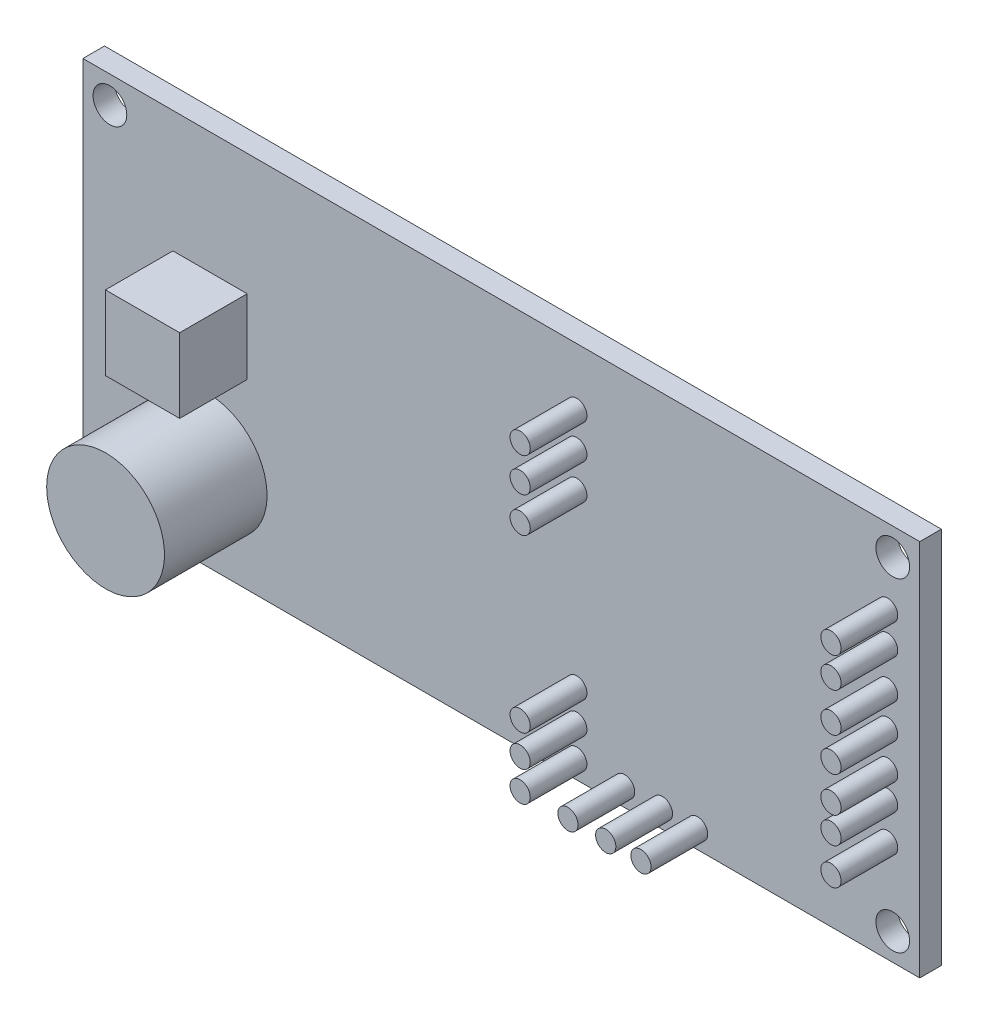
SolidWorks part; units mm, degrees
ref_plane "Front Plane" through (0, 0, 0) normal (0, 0, 1) x (1, 0, 0)
ref_plane "Top Plane" through (0, 0, 0) normal (0, 1, 0) x (1, 0, 0)
ref_plane "Right Plane" through (0, 0, 0) normal (1, 0, 0) x (0, 0, -1)
sketch "Sketch1" plane through (0, 0, 0) normal (0, 0, 1) x (1, 0, 0)
  line L0 (0, 14) -> (62, 14) construction
  line L1 (0, 0) -> (62, 0)
  line L2 (0, 0) -> (0, 28)
  line L3 (0, 28) -> (62, 28)
  line L4 (62, 0) -> (62, 28)
  circle A1 centre (2, 2) radius 1.25
  circle A2 centre (60, 26) radius 1.25
  circle A3 centre (60, 2) radius 1.25
  circle A4 centre (2, 26) radius 1.25
  dimension "D3" = 2.5
  dimension "D4" = 2.5
  dimension "D5" = 2.5
  dimension "D6" = 2.5
  dimension "D1" = 62
  dimension "D2" = 28
  dimension "D7" = 2
  dimension "D8" = 2
  dimension "D9" = 2
  dimension "D10" = 2
  dimension "D11" = 2
  dimension "D12" = 2
  dimension "D13" = 2
  dimension "D14" = 2
extrude "Extrude1" add sketch "Sketch1" along normal mid plane 1.6
sketch "Sketch3" plane through (0, 0, 0.8) normal (0, 0, 1) x (1, 0, 0)
  circle A1 centre (59.6205, 22.437) radius 0.75
  circle A2 centre (59.6205, 20.1996) radius 0.75
  circle A3 centre (59.6205, 17.3095) radius 0.75
  circle A4 centre (59.6205, 14.7924) radius 0.75
  circle A5 centre (59.6205, 12.1821) radius 0.75
  circle A6 centre (59.6205, 10.2243) radius 0.75
  circle A7 centre (59.6205, 7.5208) radius 0.75
  circle A8 centre (36.5936, 21.2251) radius 0.75
  circle A9 centre (36.5936, 23.7422) radius 0.75
  circle A10 centre (36.5936, 18.6147) radius 0.75
  circle A11 centre (36.5936, 5.9359) radius 0.75
  circle A12 centre (36.5936, 3.6052) radius 0.75
  circle A13 centre (36.5936, 1.3678) radius 0.75
  circle A14 centre (42.933, 1.3678) radius 0.75
  circle A15 centre (40.1362, 1.3678) radius 0.75
  circle A16 centre (45.5433, 1.3678) radius 0.75
  dimension "D1" = 1.5
  dimension "D2" = 1.5
  dimension "D3" = 1.5
  dimension "D4" = 1.5
  dimension "D5" = 1.5
  dimension "D6" = 1.5
  dimension "D7" = 1.5
  dimension "D8" = 1.5
  dimension "D9" = 1.5
  dimension "D10" = 1.5
  dimension "D11" = 1.5
  dimension "D12" = 1.5
  dimension "D13" = 1.5
  dimension "D14" = 1.5
  dimension "D15" = 1.5
  dimension "D16" = 1.5
extrude "Extrude3" add sketch "Sketch3" along normal blind 4.2
sketch "Sketch4" plane through (0, 0, 0.8) normal (0, 0, 1) x (1, 0, 0)
  circle A0 centre (9.2782, 6.7749) radius 4.3648
extrude "Extrude4" add sketch "Sketch4" along normal blind 7.6
sketch "Sketch5" plane through (0, 0, 0.8) normal (0, 0, 1) x (1, 0, 0)
  line L1 (6.6679, 18.9876) -> (12.1682, 18.9876)
  line L2 (6.6679, 18.9876) -> (6.6679, 13.4873)
  line L3 (6.6679, 13.4873) -> (12.1682, 13.4873)
  line L4 (12.1682, 18.9876) -> (12.1682, 13.4873)
extrude "Extrude5" add sketch "Sketch5" along normal blind 5
sketch "Sketch6" plane through (0, 0, -0.8) normal (0, 0, -1) x (-1, 0, 0)
  line L1 (-19.6264, 5.2833) -> (-15.4312, 5.2833)
  line L2 (-19.6264, 5.2833) -> (-19.6264, 1.6475)
  line L3 (-19.6264, 1.6475) -> (-15.4312, 1.6475)
  line L4 (-15.4312, 5.2833) -> (-15.4312, 1.6475)
  line L5 (-26.9913, 5.2833) -> (-22.8893, 5.2833)
  line L6 (-26.9913, 5.2833) -> (-26.9913, 1.6475)
  line L7 (-26.9913, 1.6475) -> (-22.8893, 1.6475)
  line L8 (-22.8893, 5.2833) -> (-22.8893, 1.6475)
extrude "Extrude6" add sketch "Sketch6" along normal blind 3.1
ref_plane "Plane1" through (0, 14, 0) normal (0, 1, 0) x (-1, 0, 0)
ref_plane "Plane2" through (31, 0, 0) normal (-1, 0, 0) x (0, 0, 1)
ref_point "Point1"
ref_plane "Plane3" through (60, 0, 0) normal (1, 0, 0) x (0, 0, -1)
ref_point "Point2"
ref_plane "Plane4" through (2, 0, 0) normal (-1, 0, 0) x (0, 0, 1)
